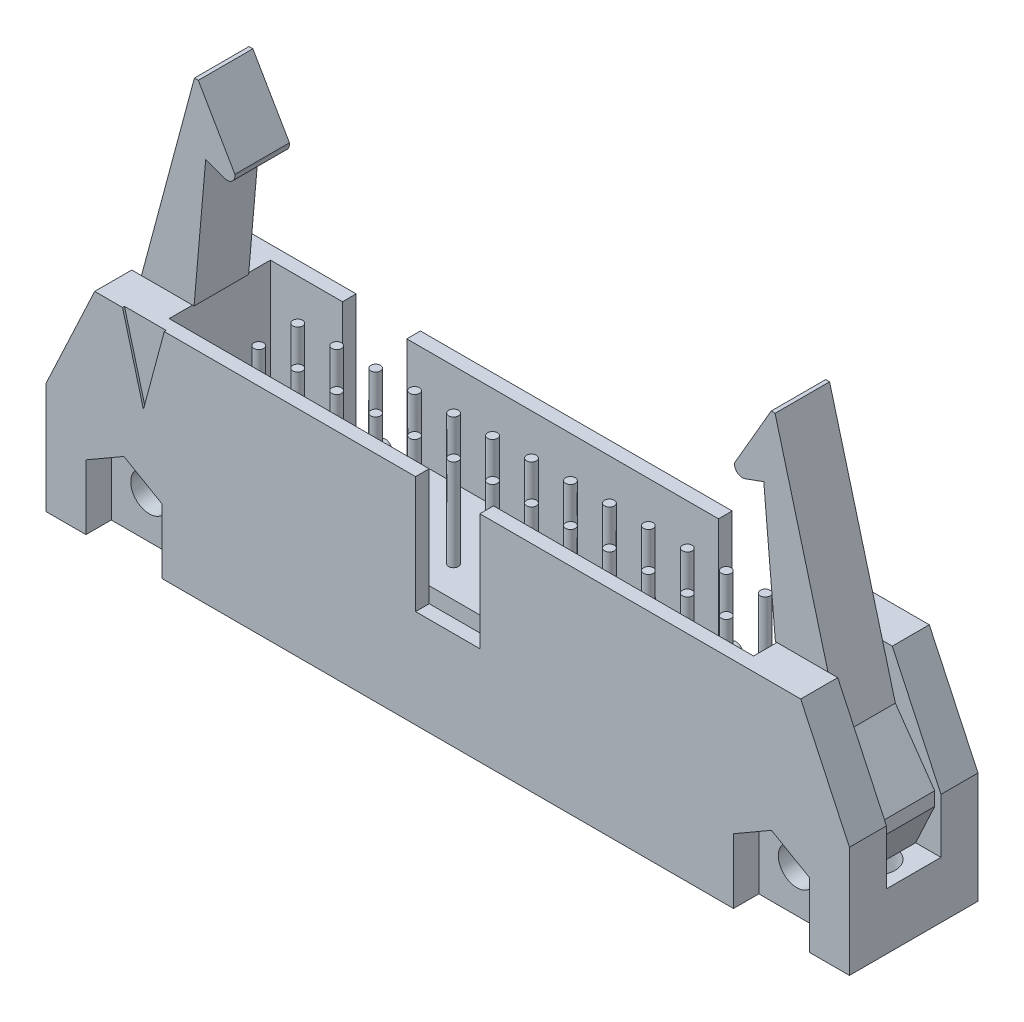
SolidWorks part; units mm, degrees
ref_plane "Front Plane" through (0, 0, 0) normal (0, 0, 1) x (1, 0, 0)
ref_plane "Top Plane" through (0, 0, 0) normal (0, 1, 0) x (1, 0, 0)
ref_plane "Right Plane" through (0, 0, 0) normal (1, 0, 0) x (0, 0, -1)
sketch "Sketch1" plane through (0, 0, 0) normal (0, 0, 1) x (1, 0, 0)
  line L1 (0, 0) -> (52.3748, 0)
  line L2 (0, 0) -> (0, 14.0208)
  line L3 (0, 14.0208) -> (52.3748, 14.0208)
  line L4 (52.3748, 0) -> (52.3748, 14.0208)
  dimension "D1" = 52.3748
  dimension "D2" = 14.0208
extrude "Base-Extrude" add sketch "Sketch1" against normal blind 8.382
sketch "Sketch2" plane through (0, 0, 0) normal (0, 0, 1) x (1, 0, 0)
  line L0 (26.1874, 14.0208) -> (26.1874, 0) construction
  line L1 (52.3748, 14.0208) -> (0, 14.0208) construction
  line L2 (0, 0) -> (52.3748, 0) construction
  line L3 (3.175, 14.0208) -> (0, 7.239)
  line L4 (0, 14.0208) -> (0, 0) construction
  line L5 (0, 14.0208) -> (0, 7.239)
  line L6 (0, 14.0208) -> (3.175, 14.0208)
  line L7 (52.3748, 14.0208) -> (49.1998, 14.0208)
  line L8 (52.3748, 14.0208) -> (52.3748, 7.239)
  line L9 (49.1998, 14.0208) -> (52.3748, 7.239)
  dimension "D1" = 7.239
  dimension "D2" = 3.175
extrude "Angle Cut Outside" cut sketch "Sketch2" against normal through all
sketch "Sketch3" plane through (0, 14.0208, 0) normal (0, 1, 0) x (-1, 0, 0)
  line L4 (-3.175, -4.191) -> (-49.1998, -4.191) construction
  line L5 (-3.175, -8.382) -> (-3.175, 0) construction
  line L6 (-49.1998, -8.382) -> (-49.1998, 0) construction
  line L7 (-26.1874, 0) -> (-26.1874, -8.382) construction
  line L8 (-49.1998, 0) -> (-3.175, 0) construction
  line L9 (-49.1998, -8.382) -> (-3.175, -8.382) construction
  line L10 (-7.1374, -7.493) -> (-7.1374, -0.889)
  line L11 (-7.1374, -0.889) -> (-45.2374, -0.889)
  line L12 (-45.2374, -7.493) -> (-45.2374, -0.889)
  line L13 (-7.1374, -7.493) -> (-45.2374, -7.493)
  point P16 (-26.1874, -0.889)
  point P18 (-45.2374, -4.191)
  point P19 (-7.1374, -4.191)
  dimension "D1" = 3.302
  dimension "D2" = 19.05
extrude "Inside Cut1" cut sketch "Sketch3" against normal blind 6.604
sketch "Sketch4" plane through (0, 0, 0) normal (0, 0, 1) x (1, 0, 0)
  line L0 (26.1874, 0) -> (26.1874, 14.0208) construction
  line L1 (0, 0) -> (52.3748, 0) construction
  line L2 (49.1998, 14.0208) -> (3.175, 14.0208) construction
  line L3 (24.0919, 14.0208) -> (24.0919, 6.4008)
  line L4 (24.0919, 6.4008) -> (28.2829, 6.4008)
  line L5 (24.0919, 14.0208) -> (28.2829, 14.0208)
  line L6 (28.2829, 14.0208) -> (28.2829, 6.4008)
  point P11 (26.1874, 6.4008)
  dimension "D1" = 2.0955
  dimension "D2" = 7.62
extrude "Center Cut1" cut sketch "Sketch4" against normal blind 0.889
sketch "Sketch5" plane through (0, 7.4168, 0) normal (0, 1, 0) x (-1, 0, 0)
  line L0 (-26.1874, 0) -> (-26.1874, -8.382) construction
  line L1 (-24.0919, 0) -> (-28.2829, 0) construction
  line L2 (-49.1998, -8.382) -> (-3.175, -8.382) construction
  line L3 (0, -4.191) -> (-52.3748, -4.191) construction
  line L4 (0, -8.382) -> (0, 0) construction
  line L5 (-52.3748, -8.382) -> (-52.3748, 0) construction
  circle A0 centre (-10.9474, -2.921) radius 0.3175
  dimension "D3" = 0.635
  dimension "D1" = 15.24
  dimension "D2" = 1.27
extrude "Pin 1 Boss" add sketch "Sketch5" along normal blind 5.969
pattern_linear "26p Pattern" count 13 spacing 2.54 along (1, 0, 0) count 2 spacing 2.54 along (0, 0, -1) of "Pin 1 Boss"
sketch "Sketch6" plane through (0, 0, -8.382) normal (0, 0, -1) x (-1, 0, 0)
  line L0 (-26.1874, 0) -> (-26.1874, 14.0208) construction
  line L1 (0, 0) -> (-52.3748, 0) construction
  line L2 (-49.1998, 14.0208) -> (-3.175, 14.0208) construction
  line L3 (-40.5384, 14.0208) -> (-40.5384, 6.4008)
  line L4 (-40.5384, 6.4008) -> (-36.3474, 6.4008)
  line L5 (-36.3474, 6.4008) -> (-36.3474, 14.0208)
  line L6 (-40.5384, 14.0208) -> (-36.3474, 14.0208)
  line L7 (-11.8364, 14.0208) -> (-16.0274, 14.0208)
  line L8 (-16.0274, 6.4008) -> (-16.0274, 14.0208)
  line L9 (-11.8364, 6.4008) -> (-16.0274, 6.4008)
  line L10 (-11.8364, 14.0208) -> (-11.8364, 6.4008)
  dimension "D1" = 4.191
  dimension "D2" = 10.16
  dimension "D3" = 7.62
extrude "Rear Cut1" cut sketch "Sketch6" against normal blind 0.889
ref_plane "Latch Plane" through (0, 0, -2.413) normal (0, 0, 1) x (1, 0, 0)
sketch "Sketch7" plane through (0, 0, -2.413) normal (0, 0, 1) x (1, 0, 0)
  line L0 (26.1874, 0) -> (26.1874, 14.0208) construction
  line L1 (0, 0) -> (52.3748, 0) construction
  line L2 (36.3474, 14.0208) -> (16.0274, 14.0208) construction
  line L3 (44.3791, 22.6702) -> (45.1358, 14.0208)
  line L4 (24.0919, 14.0208) -> (3.175, 14.0208) construction
  line L5 (7.239, 14.0208) -> (3.81, 14.0208)
  line L6 (3.81, 14.0208) -> (7.2614, 26.9014)
  line L7 (7.2614, 26.9014) -> (7.5154, 26.9014)
  line L8 (7.5154, 26.9014) -> (9.9007, 22.7878)
  line L9 (9.9007, 22.7878) -> (9.9007, 22.7024)
  line L10 (9.219, 22.225) -> (7.9957, 22.6702)
  line L11 (7.9957, 22.6702) -> (7.239, 14.0208)
  line L12 (43.1558, 22.225) -> (44.3791, 22.6702)
  line L13 (42.4741, 22.7878) -> (42.4741, 22.7024)
  line L14 (44.8594, 26.9014) -> (42.4741, 22.7878)
  line L15 (45.1134, 26.9014) -> (44.8594, 26.9014)
  line L16 (48.5648, 14.0208) -> (45.1134, 26.9014)
  line L17 (45.1358, 14.0208) -> (48.5648, 14.0208)
  arc A0 (9.219, 22.225) -> (9.9007, 22.7024) centre (9.3927, 22.7024) ccw
  arc A1 (43.1558, 22.225) -> (42.4741, 22.7024) centre (42.9821, 22.7024) cw
  dimension "D9" = 0.508
  dimension "D1" = 0.635
  dimension "D2" = 13.335
  dimension "D3" = 75
  dimension "D4" = 3.429
  dimension "D5" = 22.225
  dimension "D6" = 85
  dimension "D7" = 0.254
  dimension "D8" = 1.905
  dimension "D10" = 0.762
  dimension "D11" = 75
extrude "Latches" add sketch "Sketch7" against normal blind 3.556
sketch "Sketch8" plane through (0, 0, -2.413) normal (0, 0, 1) x (1, 0, 0)
  line L0 (7.2614, 26.9014) -> (3.81, 14.0208) construction
  line L1 (3.81, 14.0208) -> (2.9747, 10.9033)
  line L2 (26.1874, 0) -> (26.1874, 14.0208) construction
  line L3 (0, 0) -> (52.3748, 0) construction
  line L4 (24.0919, 14.0208) -> (3.175, 14.0208) construction
  line L5 (0.4089, 7.239) -> (2.9747, 10.9033)
  line L6 (0.4089, 7.239) -> (0.4089, 6.35)
  line L7 (1.6525, 3.683) -> (0, 3.683)
  line L8 (0, 7.239) -> (0, 0) construction
  line L9 (0.4089, 6.35) -> (1.6525, 3.683)
  line L10 (0, 7.239) -> (0, 3.683)
  line L11 (0, 7.239) -> (3.175, 14.0208) construction
  line L12 (0, 7.239) -> (3.175, 14.0208)
  line L13 (3.81, 14.0208) -> (3.175, 14.0208)
  line L14 (48.5648, 14.0208) -> (49.1998, 14.0208)
  line L15 (52.3748, 7.239) -> (49.1998, 14.0208)
  line L16 (52.3748, 7.239) -> (52.3748, 3.683)
  line L17 (51.9659, 6.35) -> (50.7223, 3.683)
  line L18 (50.7223, 3.683) -> (52.3748, 3.683)
  line L19 (51.9659, 7.239) -> (51.9659, 6.35)
  line L20 (51.9659, 7.239) -> (49.4001, 10.9033)
  line L21 (48.5648, 14.0208) -> (49.4001, 10.9033)
  dimension "D1" = 3.683
  dimension "D2" = 1.6525
  dimension "D3" = 6.35
  dimension "D4" = 65
  dimension "D5" = 160
extrude "Latch Cut1" cut sketch "Sketch8" against normal blind 3.556
sketch "Sketch9" plane through (0, 0, 0) normal (0, 0, 1) x (1, 0, 0)
  line L0 (4.9888, 14.0208) -> (6.35, 8.9408)
  line L1 (24.0919, 14.0208) -> (3.175, 14.0208) construction
  line L2 (6.35, 8.9408) -> (7.7112, 14.0208)
  line L3 (7.7112, 14.0208) -> (4.9888, 14.0208)
  line L4 (6.35, 14.0208) -> (6.35, 0) construction
  line L5 (0, 0) -> (52.3748, 0) construction
  dimension "D1" = 30
  dimension "D2" = 6.35
  dimension "D3" = 5.08
extrude "Pin 1 Triangle Cut" cut sketch "Sketch9" against normal blind 0.127
sketch "Sketch10" plane through (0, 0, 0) normal (0, 0, 1) x (1, 0, 0)
  line L0 (26.1874, 0) -> (26.1874, 14.0208) construction
  line L1 (0, 0) -> (52.3748, 0) construction
  line L2 (36.3474, 14.0208) -> (16.0274, 14.0208) construction
  line L3 (5.9524, 0.4381) -> (7.3994, 1.2735)
  line L4 (2.271, 1.5562) -> (3.718, 0.7208)
  line L5 (7.5565, 0) -> (7.5565, 4.2238)
  line L6 (7.5565, 4.2238) -> (5.08, 5.6536)
  line L7 (5.08, 5.6536) -> (2.6035, 4.2238)
  line L8 (2.6035, 4.2238) -> (2.6035, 0)
  line L9 (2.6035, 0) -> (7.5565, 0)
  line L10 (49.7713, 0) -> (44.8183, 0)
  line L11 (49.7713, 4.2238) -> (49.7713, 0)
  line L12 (47.2948, 5.6536) -> (49.7713, 4.2238)
  line L13 (44.8183, 4.2238) -> (47.2948, 5.6536)
  line L14 (44.8183, 0) -> (44.8183, 4.2238)
  circle A0 centre (5.08, 2.794) radius 2.4765 construction
  circle A1 centre (47.2948, 2.794) radius 2.4765 construction
  dimension "D1" = 4.953
  dimension "D2" = 2.794
  dimension "D3" = 5.08
  dimension "D4" = 21.1074
extrude "Screw Recess" cut sketch "Sketch10" against normal blind 1.651
sketch "Sketch12" plane through (0, 0, 0) normal (0, 0, 1) x (1, 0, 0)
  line L0 (26.1874, 0) -> (26.1874, 14.0208) construction
  line L1 (7.5565, 0) -> (44.8183, 0) construction
  line L2 (36.3474, 14.0208) -> (16.0274, 14.0208) construction
  circle A0 centre (5.08, 2.794) radius 1.2065
  circle A1 centre (47.2948, 2.794) radius 1.2065
  dimension "D1" = 2.413
extrude "Screw Hole" cut sketch "Sketch12" against normal through all
sketch "Sketch13" plane through (0, 0, 0) normal (0, -1, 0) x (1, 0, 0)
  line L0 (26.1874, -8.382) -> (26.1874, 0) construction
  line L1 (0, -8.382) -> (52.3748, -8.382) construction
  line L2 (7.5565, 0) -> (44.8183, 0) construction
  line L3 (0, -8.382) -> (0, 0) construction
  circle A0 centre (2.032, -3.7338) radius 1.27
  circle A1 centre (50.3428, -3.7338) radius 1.27
  dimension "D1" = 2.54
  dimension "D2" = 3.7338
  dimension "D3" = 2.032
  dimension "D4" = 24.1554
extrude "Vert Mnt Hole" cut sketch "Sketch13" against normal up to surface (3.683 mm away)
sketch "Sketch15" plane through (0, 0, -8.382) normal (0, 0, -1) x (-1, 0, 0)
  line L0 (-26.1874, 0) -> (-26.1874, 14.0208) construction
  line L1 (0, 0) -> (-52.3748, 0) construction
  line L2 (-36.3474, 14.0208) -> (-16.0274, 14.0208) construction
  line L3 (-8.9154, 0) -> (-8.9154, 4.318)
  line L4 (-8.9154, 4.318) -> (-43.4594, 4.318)
  line L5 (-43.4594, 0) -> (-8.9154, 0)
  line L6 (-43.4594, 0) -> (-43.4594, 4.318)
  point P10 (-26.1874, 4.318)
  dimension "D1" = 17.272
  dimension "D2" = 4.318
extrude "R Ang Rear Cut1" cut sketch "Sketch15" against normal blind 1.524
sketch "Sketch14" plane through (0, 0, -6.858) normal (0, 0, -1) x (-1, 0, 0)
  line L0 (-47.2948, 2.794) -> (-5.08, 2.794) construction
  line L1 (-26.1874, 2.794) -> (-26.1874, 14.0208) construction
  line L3 (-36.3474, 14.0208) -> (-16.0274, 14.0208) construction
  circle A0 centre (-10.9474, 0.9906) radius 0.4445
  dimension "D1" = 0.889
  dimension "D2" = 1.8034
  dimension "D3" = 15.24
extrude "R Ang Pin1" add sketch "Sketch14" along normal blind 4.318
pattern_linear "R Ang Pattern" count 13 spacing 2.54 along (1, 0, 0) count 2 spacing 2.54 along (0, 1, 0) of "R Ang Pin1"
